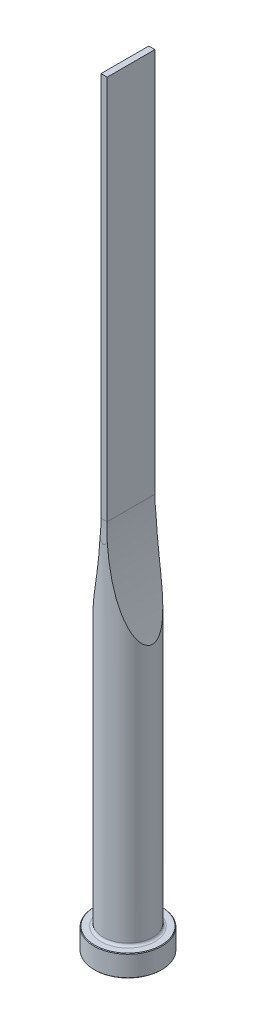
SolidWorks part; units mm, degrees
ref_plane "Front Plane" through (0, 0, 0) normal (0, 0, 1) x (1, 0, 0)
ref_plane "Top Plane" through (0, 0, 0) normal (0, 1, 0) x (1, 0, 0)
ref_plane "Right Plane" through (0, 0, 0) normal (1, 0, 0) x (0, 0, -1)
sketch "Sketch1" plane through (0, 0, 0) normal (0, 0, 1) x (1, 0, 0)
  line L0 (0, 0) -> (10.8, 0)
  line L1 (55, 0) -> (-55, 0) construction
  line L2 (11, 0.2) -> (11, 6.8)
  line L3 (10.8, 7) -> (8.8, 7)
  line L4 (8, 7.8) -> (8, 250)
  line L5 (0, 250) -> (8, 250)
  line L6 (11, 6.8) -> (10.8, 7)
  line L7 (10.8, 0) -> (11, 0.2)
  line L8 (0, 250) -> (0, 0)
  arc A0 (8, 7.8) -> (8.8, 7) centre (8.8, 7.8) ccw
  point P1 (11, 0)
  point P6 (11, 7)
  dimension "D4" = 0.8
  dimension "D1" = 8
  dimension "D2" = 11
  dimension "D3" = 7
  dimension "D5" = 250
revolve "Revolve1" add sketch "Sketch1" angle 360 about L8
sketch "Sketch2" plane through (0, 0, 0) normal (0, 0, 1) x (1, 0, 0)
  line L0 (1, 250) -> (1, 125)
  line L1 (8, 250) -> (-8, 250) construction
  line L2 (-1, 250) -> (-1, 125)
  line L3 (8, 250) -> (8, 90.2006)
  line L4 (-8, 250) -> (-8, 90.2006)
  line L5 (0, -12.1) -> (0, 12.1) construction
  line L6 (8, 250) -> (1, 250)
  line L8 (-1, 250) -> (-8, 250)
  arc A0 (1, 125) -> (8, 90.2006) centre (91, 125) ccw
  arc A1 (-1, 125) -> (-8, 90.2006) centre (-91, 125) cw
  dimension "D4" = 90
  dimension "D1" = 125
  dimension "D2" = 2
  dimension "D3" = 1
extrude "Cut-Extrude1" cut sketch "Sketch2" against normal mid plane 20
sketch "Sketch3" plane through (0, 0, 0) normal (1, 0, 0) x (0, 0, -1)
  line L0 (7.75, 250) -> (7.75, 125)
  line L1 (-7.9373, 250) -> (7.9373, 250) construction
  line L2 (-7.75, 250) -> (-7.75, 125)
  line L3 (8, 250) -> (8, 118.2965)
  line L4 (7.75, 250) -> (8, 250)
  line L5 (0, 12.1) -> (0, -12.1) construction
  line L6 (-8, 250) -> (-8, 118.2965)
  line L8 (-7.75, 250) -> (-8, 250)
  arc A0 (7.75, 125) -> (8, 118.2965) centre (97.75, 125) ccw
  arc A1 (-7.75, 125) -> (-8, 118.2965) centre (-97.75, 125) cw
  dimension "D2" = 90
  dimension "D1" = 125
  dimension "D3" = 15.5
  dimension "D4" = 7.75
extrude "Cut-Extrude2" cut sketch "Sketch3" against normal mid plane 20
